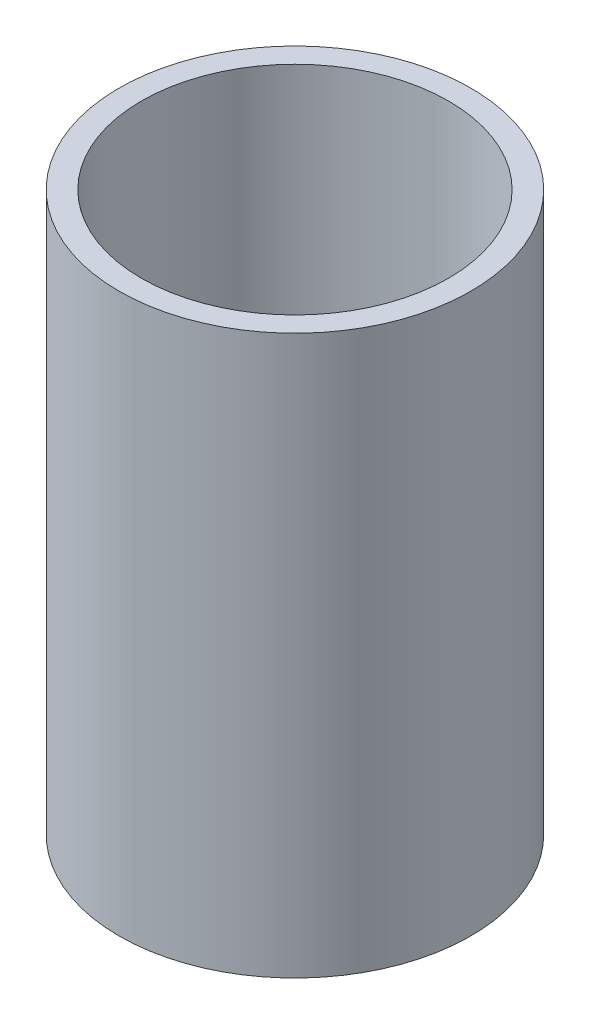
SolidWorks part; units mm, degrees
ref_plane "Ebene vorne" through (0, 0, 0) normal (0, 0, 1) x (1, 0, 0)
ref_plane "Ebene oben" through (0, 0, 0) normal (0, 1, 0) x (1, 0, 0)
ref_plane "Ebene rechts" through (0, 0, 0) normal (1, 0, 0) x (0, 0, -1)
sketch "Skizze1" plane through (0, 0, 0) normal (0, 1, 0) x (1, 0, 0)
  circle A0 centre (0, 0) radius 31.5
  circle A1 centre (0, 0) radius 27.5
  dimension "D1" = 4
extrude "Aufsatz-Linear austragen1" add sketch "Skizze1" along normal blind 100
